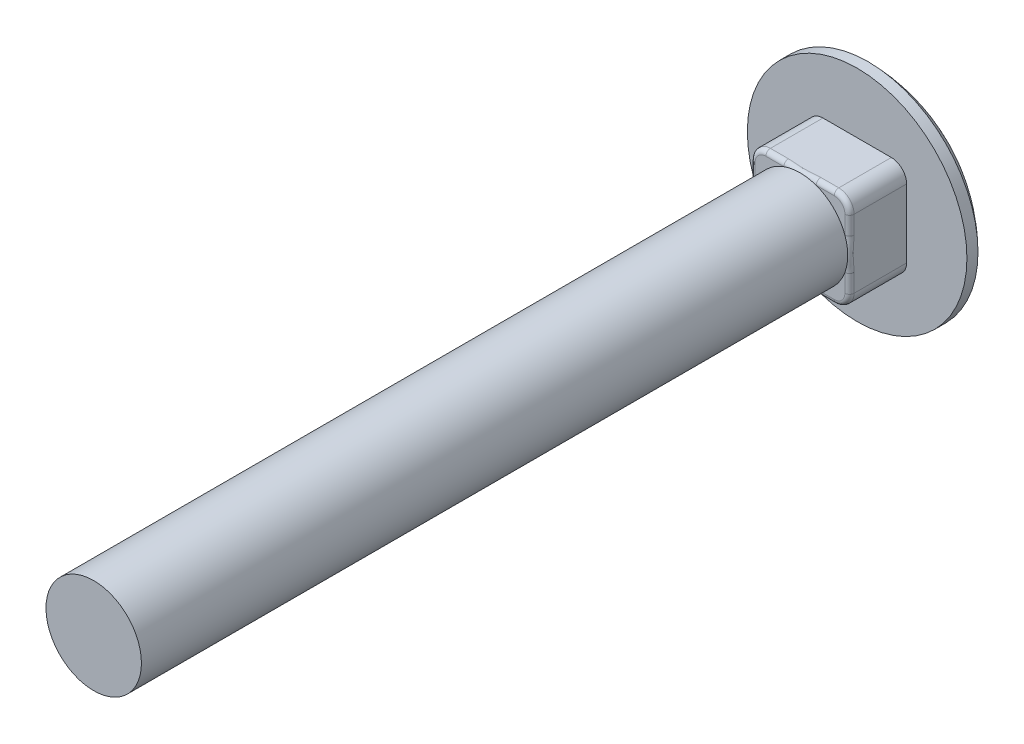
SolidWorks part; units mm, degrees
ref_plane "Front Plane" through (0, 0, 0) normal (0, 0, 1) x (1, 0, 0)
ref_plane "Top Plane" through (0, 0, 0) normal (0, 1, 0) x (1, 0, 0)
ref_plane "Right Plane" through (0, 0, 0) normal (1, 0, 0) x (0, 0, -1)
sketch "Sketch1" plane through (0, 0, 0) normal (1, 0, 0) x (0, 0, -1)
  line L0 (0, 0) -> (4.4704, 0)
  line L1 (0, 9.1313) -> (0.9207, 9.1313)
  line L2 (0, 0) -> (0, 9.1313)
  line L3 (0, 0) -> (15.0876, 0) construction
  arc A0 (0.9207, 9.1313) -> (4.4704, 0) centre (-8.2256, 0.3202) cw
  dimension "HeadRadius" = 12.7
  dimension "Head Height" = 4.4704
  dimension "Head dia/2" = 9.1313
  dimension "1/4ofHeight" = 0.9207
revolve "Revolve1" add sketch "Sketch1" angle 360 about L3
sketch "Sketch2" plane through (0, 0, 0) normal (0, 0, 1) x (1, 0, 0)
  line L0 (0, 0) -> (4.1148, 4.1148) construction
  line L1 (-4.1148, 4.1148) -> (4.1148, 4.1148)
  line L2 (-4.1148, 4.1148) -> (-4.1148, -4.1148)
  line L3 (-4.1148, -4.1148) -> (4.1148, -4.1148)
  line L4 (4.1148, 4.1148) -> (4.1148, -4.1148)
  dimension "D1" = 45
  dimension "Neck Width" = 8.2296
  dimension "NeckWidth/2" = 4.1148
extrude "Extrude1" add sketch "Sketch2" along normal blind 4.7498
sketch "Sketch3" plane through (0, 0, 4.7498) normal (0, 0, 1) x (1, 0, 0)
  circle A0 centre (0, 0) radius 3.9688
  dimension "Thread" = 7.9375
extrude "Extrude2" add sketch "Sketch3" along normal blind 58.7426
fillet "Fillet1" radius 1.27 4 edges at (-4.1148, 4.1148, 2.3749) (-4.1148, -4.1148, 2.3749) (4.1148, -4.1148, 2.3749) (4.1148, 4.1148, 2.3749)
fillet "Fillet2" radius 0.381 8 edges at (4.1148, 0, 4.7498) (3.7428, -3.7428, 4.7498) (0, -4.1148, 4.7498) (-3.7428, -3.7428, 4.7498) (-4.1148, 0, 4.7498) (-3.7428, 3.7428, 4.7498) (0, 4.1148, 4.7498) (3.7428, 3.7428, 4.7498)
